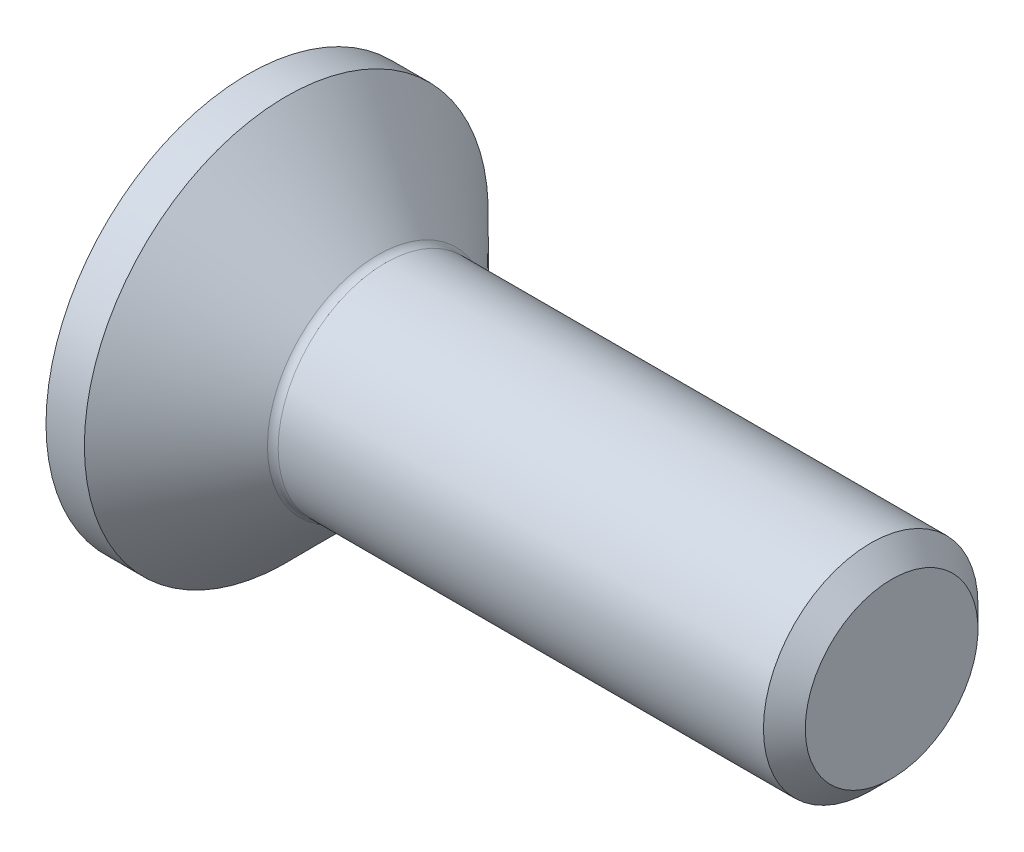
SolidWorks part; units mm, degrees
revolve "PreBroach" cut sketch "Sketch2"
sketch "Sketch2"
  line L0 (0, 1.26) -> (1.5, 1.26)
  line L1 (1.5, 1.26) -> (2.2275, 0)
  line L2 (0, 0) -> (127, 0) construction
  line L3 (2.2275, 0) -> (0, 0)
  line L4 (0, 0) -> (0, 1.26)
  line L5 (0, -1.26) -> (1.5, -1.26) construction
  line L6 (0, 0) -> (47.625, 0) construction
  line L8 (0, 3.765) -> (0, -3.765) construction
revolve "BaseBody" add sketch "BodySke" angle 360 about L6
sketch "BodySke" plane through (0, 0, 0) normal (0, 0, 1) x (1, 0, 0)
  line L0 (0, 0) -> (0, 3.765)
  line L1 (0.715, 3.765) -> (2.48, 2)
  line L2 (0, 3.765) -> (0.715, 3.765)
  line L3 (2.48, 2) -> (11.61, 2)
  line L4 (12, 1.61) -> (12, 0)
  line L5 (12, 0) -> (0, 0)
  line L6 (0, 0) -> (127, 0) construction
  line L7 (0.715, -3.765) -> (2.48, -2) construction
  line L8 (12, 1.61) -> (11.61, 2)
  line L9 (0, -3.765) -> (0.715, -3.765) construction
  line L10 (12, -1.61) -> (11.61, -2) construction
  line L11 (3.18, 8.35) -> (3.18, -13.875) construction
  line L12 (0, 16.35) -> (0, -5.875) construction
ref_plane "Plane1" through (0, 0, 0) normal (0, 0, 1) x (1, 0, 0)
ref_plane "Plane2" through (0, 0, 0) normal (0, 1, 0) x (1, 0, 0)
ref_plane "Plane3" through (0, 0, 0) normal (1, 0, 0) x (0, 0, -1)
fillet "Fillet1" radius 0.2 1 edges at (2.48, 0, 2)
sketch "Sketch3" plane through (0, 0, 0) normal (-1, 0, 0) x (0, 0, 1)
  line L0 (-1.26, -0.7275) -> (-1.26, 0.7275)
  line L1 (-1.26, 0.7275) -> (0, 1.4549)
  line L2 (0, 1.4549) -> (1.26, 0.7275)
  line L3 (1.26, 0.7275) -> (1.26, -0.7275)
  line L4 (1.26, -0.7275) -> (0, -1.4549)
  line L5 (0, -1.4549) -> (-1.26, -0.7275)
extrude "Hex" cut sketch "Sketch3" against normal blind 1.5
sketch "ThdSchSke" plane through (0, 0, 0) normal (0, 0, 1) x (1, 0, 0)
  line L0 (3.53, -1.61) -> (3.2569, -2)
  line L1 (3.53, -1.61) -> (3.8031, -2)
  line L2 (3.8031, -2) -> (3.8031, -2.5)
  line L3 (-3.175, 0) -> (5.1513, 0) construction
  line L4 (0, 3.765) -> (0, -3.765) construction
  line L5 (3.8031, -2.5) -> (3.2569, -2.5)
  line L6 (3.2569, -2.5) -> (3.2569, -2)
revolve "ThreadSchematic" [suppressed] cut sketch "ThdSchSke" angle 360 about L3
pattern_linear "ThdSchPat" [suppressed]
equation "\"Thread_minor@ThreadCosmetic\"  =  \"Minor_dia@BodySke\""
equation "\"D1@Sketch3\" = \"Hex_size@Sketch3\" / 2"
equation "\"D2@Sketch3\" = \"D1@Sketch3\""
equation "\"D3@Sketch3\" = \"Hex_size@Sketch3\""
equation "\"Thread_length@ThreadCosmetic\" = ((sgn( (\"Length@BodySke\" - \"Advance@BodySke\" * 1.5 - \"Head_ht@BodySke\" ) - \"Thread_nom@BodySke\" )-1)*( (\"Length@BodySke\" - \"Advance@BodySke\" * 1.5 - \"Head_ht@BodySke\" "
equation "\"Thread_minor@ThdSchSke\" = \"Minor_dia@BodySke\""
equation "\"Diameter@ThdSchSke\" = \"Diameter@BodySke\""
equation "\"Overcut@ThdSchSke\" = \"Diameter@BodySke\" * 1.25"
equation "\"Start@ThdSchSke\" = 0.000001 + \"Length@BodySke\" - \"Thread_length@ThreadCosmetic\"  '---Countersunk---"
equation "\"Num_threads@ThdSchPat\" = int( \"Thread_length@ThreadCosmetic\" / \"Advance@BodySke\" + 0.999 )  + 1"
equation "\"Advance@ThdSchPat\" = \"Thread_length@ThreadCosmetic\" /  (\"Num_threads@ThdSchPat\" - 1) 'relax it"
equation "\"Num_threads@ThdSchPat\" = \"Num_threads@ThdSchPat\" - sgn( \"Num_threads@ThdSchPat\" - 1) '---chamfered tips only---"
